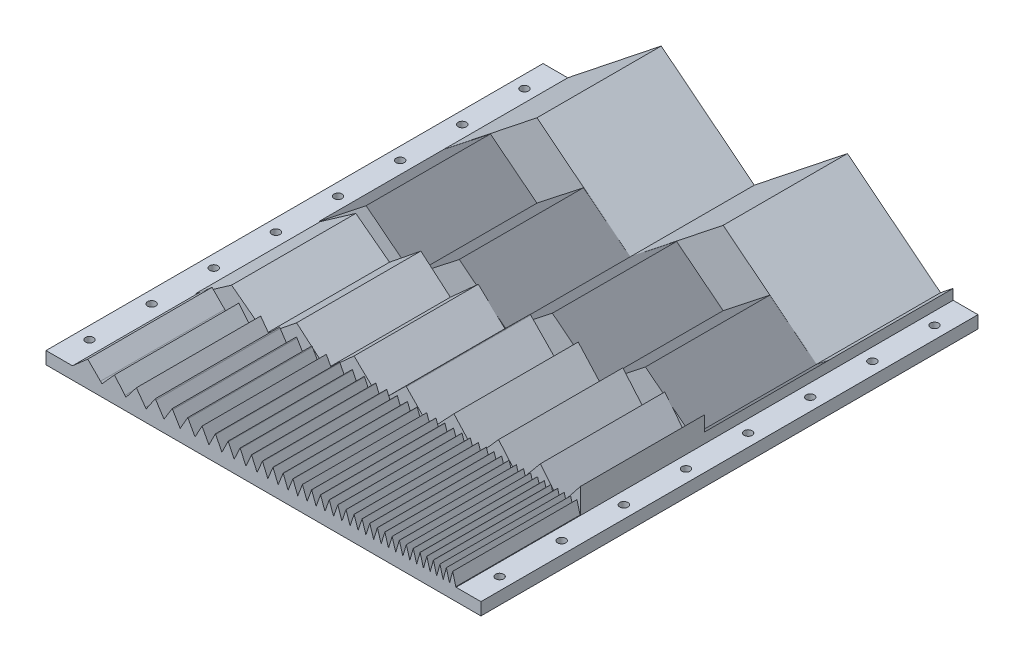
SolidWorks part; units mm, degrees
ref_plane "Front Plane" through (0, 0, 0) normal (0, 0, 1) x (1, 0, 0)
ref_plane "Top Plane" through (0, 0, 0) normal (0, 1, 0) x (1, 0, 0)
ref_plane "Right Plane" through (0, 0, 0) normal (1, 0, 0) x (0, 0, -1)
imported_body "triangRow1-1-solid1"
imported_body "triangRow2-1-solid1"
imported_body "triangRow3-1-solid1"
imported_body "triangRow4-1-solid1"
combine bodies "Combine1" operation type add bodies to combine 101 102 103 104
